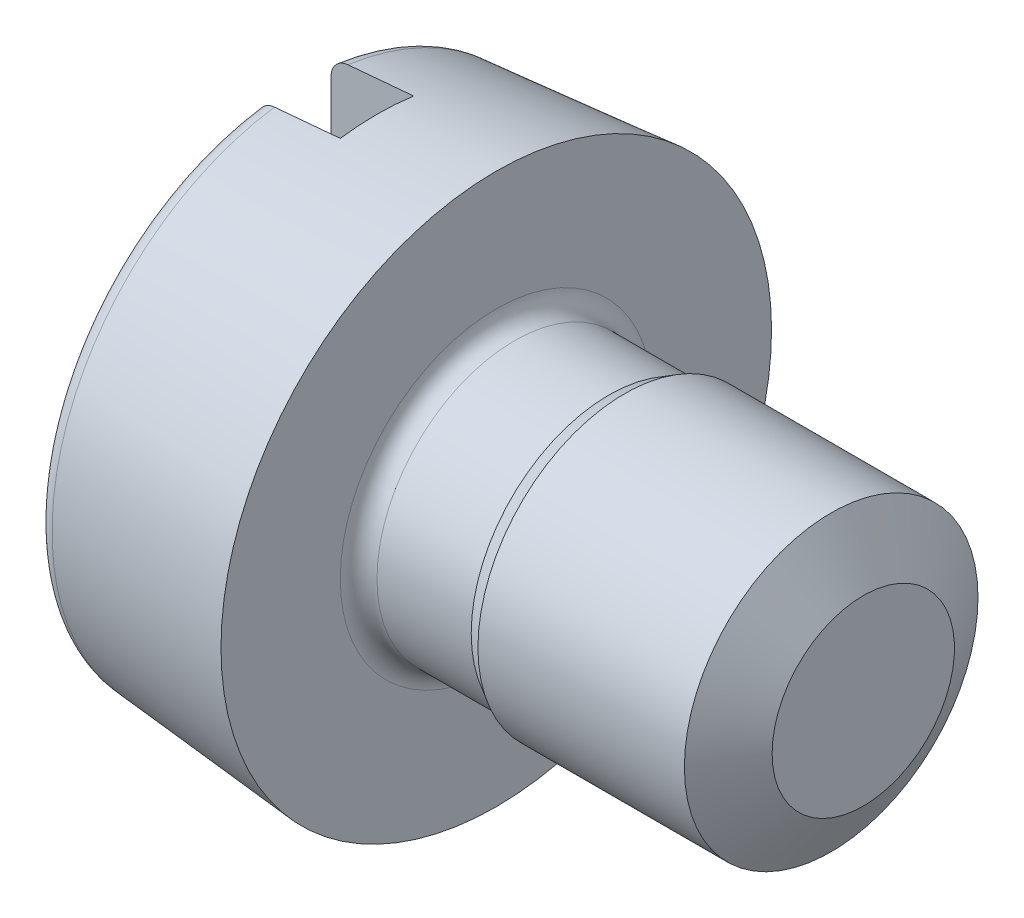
SolidWorks part; units mm, degrees
ref_plane "前视" through (0, 0, 0) normal (0, 0, 1) x (1, 0, 0)
ref_plane "上视" through (0, 0, 0) normal (0, 1, 0) x (1, 0, 0)
ref_plane "右视" through (0, 0, 0) normal (1, 0, 0) x (0, 0, -1)
sketch "尺寸草图" plane through (0, 0, 0) normal (0, 0, 1) x (1, 0, 0)
  line L0 (0, 0) -> (3.1, 0)
  point P3 (0.45, 0)
  point P4 (0.7, 0)
  point P5 (1.6, 0)
  point P6 (3, 0)
  point P7 (0.4, 0)
  point P8 (3.1989, 0)
  point P9 (3.656, 0)
  point P10 (4.0948, 0)
  point P11 (2.75, 0)
  point P12 (3, 0)
  point P13 (1.1, 0)
  dimension "k" = 1.1
  dimension "t" = 0.45
  dimension "a" = 0.7
  dimension "d" = 1.6
  dimension "l" = 2
  dimension "dk" = 3
  dimension "n" = 0.4
  dimension "r" = 0.1
  dimension "p" = 0.35
sketch "草图1" plane through (0, 0, 0) normal (0, 0, 1) x (1, 0, 0)
  line L0 (0, 0) -> (3.1, 0) construction
  line L1 (0, 0) -> (0, 1.3121)
  line L2 (1.1, 1.5) -> (0.0913, 1.4117)
  line L3 (1.1, 1.5) -> (1.1, 0.85)
  line L4 (1.2, 0.75) -> (1.7134, 0.75)
  line L5 (1.7134, 0.75) -> (1.8, 0.8)
  line L6 (1.8, 0.8) -> (3.1, 0.8)
  line L7 (3.1, 0.8) -> (3.1, 0)
  line L8 (0, 0) -> (3.1, 0)
  arc A0 (1.2, 0.75) -> (1.1, 0.85) centre (1.2, 0.85) cw
  arc A1 (0, 1.3121) -> (0.0913, 1.4117) centre (0.1, 1.3121) cw
  dimension "r" = 0.1
  dimension "D10" = 0.1
  dimension "D1" = 1.5
  dimension "D2" = 85
  dimension "d" = 1.6
  dimension "a" = 0.7
  dimension "D8" = 30
  dimension "k" = 1.1
  dimension "dk" = 3
  dimension "l" = 2
revolve "基体-旋转" add sketch "草图1" angle 360 about L0
sketch "草图2" plane through (0, 0, 0) normal (-1, 0, 0) x (0, 0, 1)
  line L0 (0, 0) -> (0, -1.8809) construction
  line L3 (0.2, 1.4866) -> (0.2, -1.4866)
  line L5 (-0.2, 1.4866) -> (-0.2, -1.4866)
  circle A1 centre (0, 0) radius 1.5 construction
  arc A2 (0.2, 1.4866) -> (-0.2, 1.4866) centre (0, 0) ccw
  arc A3 (-0.2, -1.4866) -> (0.2, -1.4866) centre (0, 0) ccw
  dimension "n" = 0.4
extrude "切除-拉伸1" cut sketch "草图2" against normal blind 0.45
sketch "草图3" plane through (0, 0, 0) normal (0, 1, 0) x (1, 0, 0)
  line L0 (2.925, 0.8) -> (3.275, 0.8)
  line L2 (3.275, 0.8) -> (3.1, 0.4969)
  line L3 (3.1, 0.4969) -> (2.925, 0.8)
  line L4 (3.1, -1.6037) -> (3.1, 3.368) construction
  line L10 (3.1, -0.8) -> (3.1, 0.8) construction
  line L11 (0, 0) -> (7.2232, 0) construction
  dimension "D1" = 120
  dimension "D2" = 0.3031
  dimension "D3" = 0.8
revolve "切除-旋转1" cut sketch "草图3" angle 360 about L11
pattern_linear "阵列(线性)1" [suppressed] count 5 along (1, 0, 0)
equation "\"l@草图1\" = \"l@尺寸草图\" "
equation "\"a@草图1\" = \"a@尺寸草图\" "
equation "\"r@草图1\" = \"r@尺寸草图\" "
equation "\"d@草图1\" = \"d@尺寸草图\" "
equation "\"k@草图1\" = \"k@尺寸草图\" "
equation "\"dk@草图1\" = \"dk@尺寸草图\" "
equation "\"n@草图2\" = \"n@尺寸草图\" "
equation "\"t@切除-拉伸1\" = \"t@尺寸草图\" "
equation "\"p@阵列(线性)1\" = \"p@尺寸草图\" "
equation "\"D2@草图3\" = \"p@尺寸草图\" * 0.866"
equation "\"D3@草图3\" = \"d@草图1\" / 2"
equation "\"D1@草图1\" = \"d@草图1\" - \"r@草图1\""
equation "\"D1@阵列(线性)1\" =  ( \"l@草图1\" - \"a@草图1\" )  / \"p@阵列(线性)1\" + 1"
